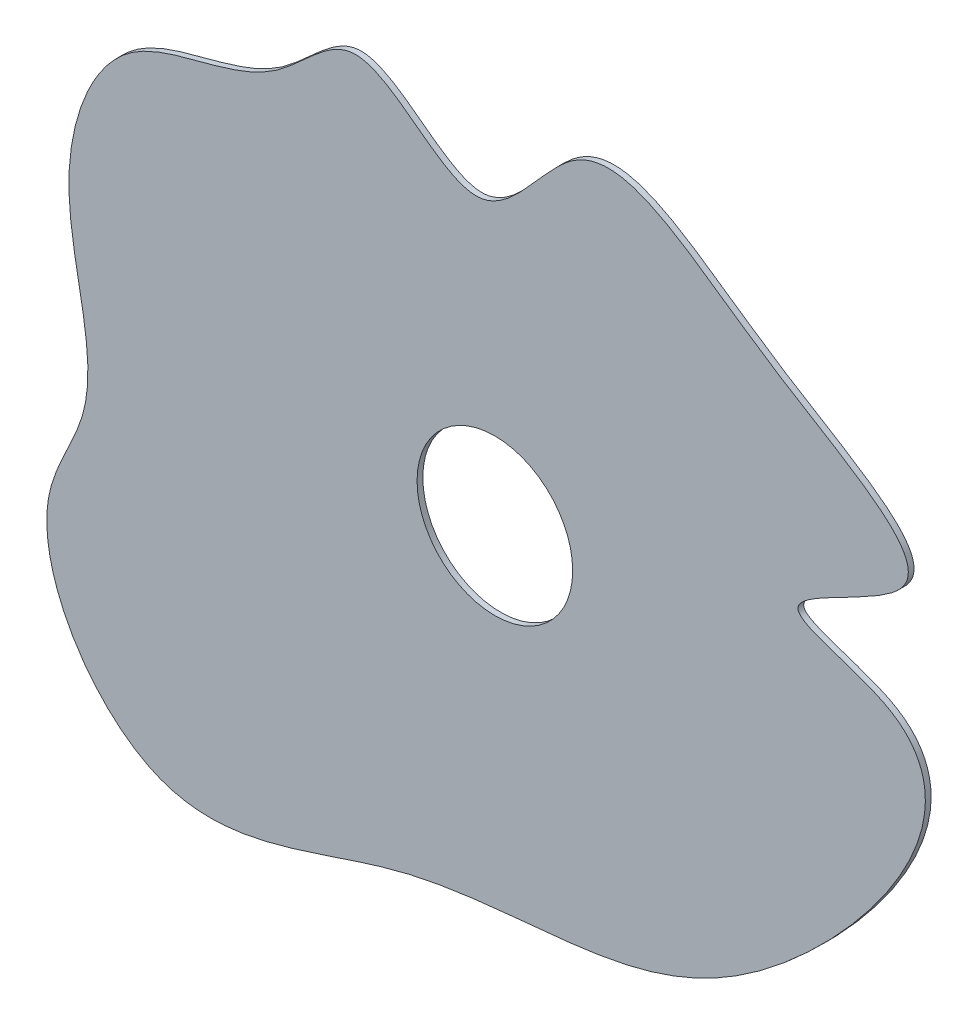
SolidWorks part; units mm, degrees
ref_plane "Plan de face" through (0, 0, 0) normal (0, 0, 1) x (1, 0, 0)
ref_plane "Plan de dessus" through (0, 0, 0) normal (0, 1, 0) x (1, 0, 0)
ref_plane "Plan de droite" through (0, 0, 0) normal (1, 0, 0) x (0, 0, -1)
sketch "Esquisse1" plane through (0, 0, 0) normal (0, 0, 1) x (1, 0, 0)
  spline S0 degree 3 poles (-6.8692, 51.3381) (-23.5656, 28.0856) (-49.8355, 29.489) (-62.3919, -3.5812) (-49.5735, -29.2286) (-67.8036, -55.1856) (-42.8025, -95.1435) (-1.7305, -71.9431) (37.385, -72.9632) (70.6226, -58.0375) (106.8975, -9.7323) (56.9158, -2.2767) (103.0983, 12.043) (58.3803, 33.1563) (33.0337, 58.8657) (13.5078, 22.1421) (-6.8692, 51.3381) (-23.5656, 28.0856) (-49.8355, 29.489) knots -0.12907 -0.085033 -0.034258 0 0.057183 0.112714 0.185714 0.219037 0.298383 0.389371 0.469137 0.539977 0.643888 0.680328 0.725797 0.790807 0.87093 0.914967 0.965742 1 1.057183 1.112714 1.185714 only from (-21.6614, 34.0549) to (-21.6614, 34.0549)
extrude "Extrusion1" add sketch "Esquisse1" along normal blind 1
sketch "Esquisse2" plane through (0, 0, 0) normal (0, 0, -1) x (-1, 0, 0)
  circle A0 centre (-16.2043, -15.4709) radius 13.5
  dimension "D1" = 27
extrude "Extrusion2" cut sketch "Esquisse2" against normal blind 10
